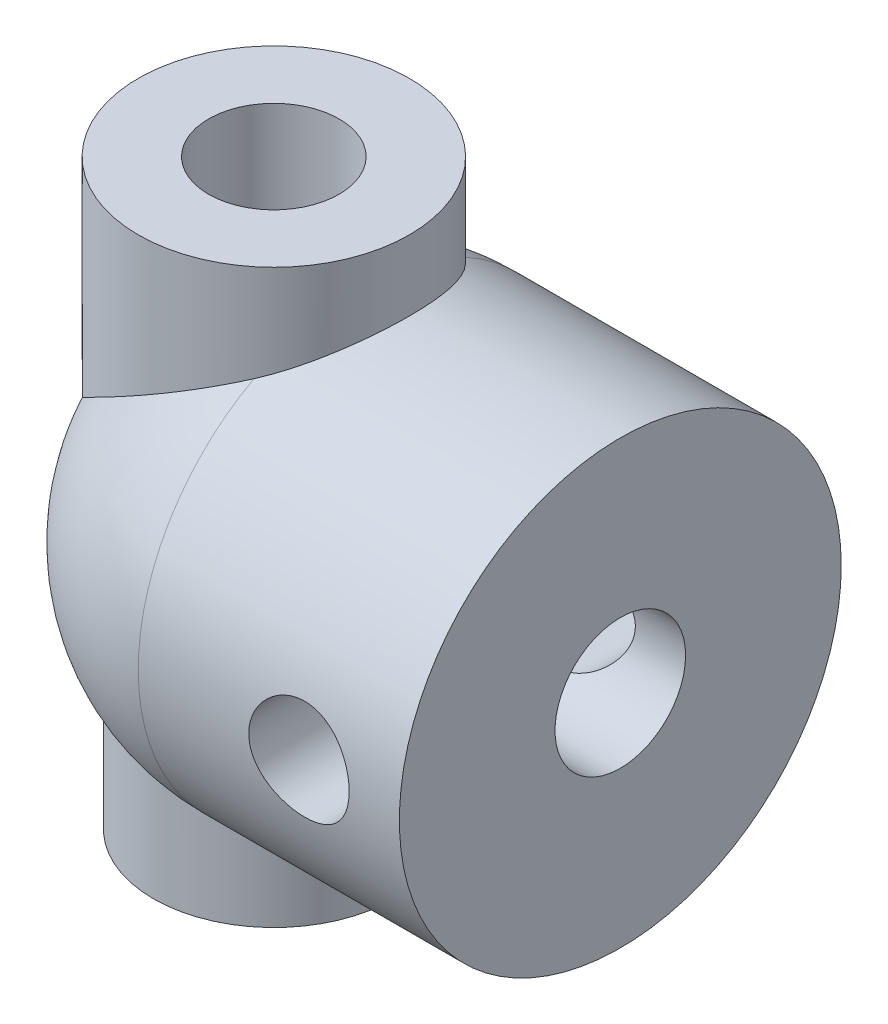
SolidWorks part; units mm, degrees
ref_plane "前视基准面" through (0, 0, 0) normal (0, 0, 1) x (1, 0, 0)
ref_plane "上视基准面" through (0, 0, 0) normal (0, 1, 0) x (1, 0, 0)
ref_plane "右视基准面" through (0, 0, 0) normal (1, 0, 0) x (0, 0, -1)
sketch "草图1" plane through (0, 0, 0) normal (1, 0, 0) x (0, 0, -1)
  circle A0 centre (0, 0) radius 88
extrude "拉伸1" add sketch "草图1" along normal blind 104
sketch "草图2" plane through (0, 0, 0) normal (0, 0, 1) x (1, 0, 0)
  line L0 (-88, 0) -> (0, 0)
  line L1 (0, 0) -> (0, 88)
  arc A0 (0, 88) -> (-88, 0) centre (0, 0) ccw
revolve "旋转1" add sketch "草图2" angle 360 about L0
sketch "草图3" plane through (0, 0, 0) normal (0, 1, 0) x (1, 0, 0)
  line L0 (-67.0388, 0) -> (-116.0901, 0) construction
  circle A0 centre (-34, 0) radius 54
  point P5 (-88, 0)
  dimension "D1" = 88
extrude "拉伸2" add sketch "草图3" along normal blind 116
sketch "草图4" plane through (0, 0, 0) normal (0, 1, 0) x (1, 0, 0)
  circle A0 centre (-34, 0) radius 48
extrude "拉伸3" add sketch "草图4" against normal blind 116
sketch "草图5" plane through (0, 116, 0) normal (0, 1, 0) x (1, 0, 0)
  circle A0 centre (-34, 0) radius 26
extrude "切除-拉伸1" cut sketch "草图5" against normal through all
sketch "草图6" plane through (104, 0, 0) normal (1, 0, 0) x (0, 0, -1)
  circle A0 centre (0, 0) radius 26
extrude "切除-拉伸2" cut sketch "草图6" against normal blind 138
sketch "草图7" plane through (0, 0, 0) normal (0, 0, 1) x (1, 0, 0)
  line L0 (-34, 85.8256) -> (-34, 25.5736) construction
  line L2 (-8, 26) -> (-8, 116) construction
  dimension "D1" = 26
sketch "草图8" plane through (0, 0, 0) normal (0, 0, 1) x (1, 0, 0)
  line L0 (104, -88) -> (104, 88) construction
  circle A0 centre (64, 0) radius 20
  dimension "D1" = 40
extrude "切除-拉伸3" cut sketch "草图8" against normal through all and the other way through all
